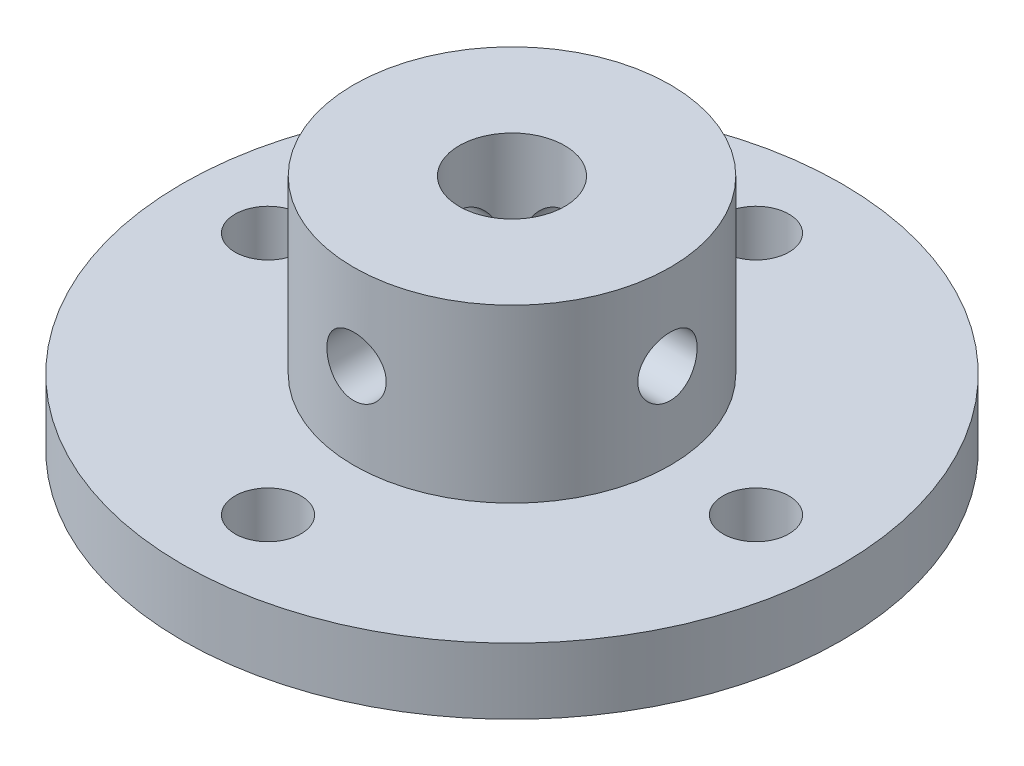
SolidWorks part; units mm, degrees
ref_plane "前视基准面" through (0, 0, 0) normal (0, 0, 1) x (1, 0, 0)
ref_plane "上视基准面" through (0, 0, 0) normal (0, 1, 0) x (1, 0, 0)
ref_plane "右视基准面" through (0, 0, 0) normal (1, 0, 0) x (0, 0, -1)
other "Configuration Table"
sketch "草图1" plane through (0, 0, 0) normal (0, 1, 0) x (1, 0, 0)
  circle A0 centre (0, 0) radius 25
  dimension "D1" = 50
extrude "凸台-拉伸1" add sketch "草图1" along normal blind 5
sketch "草图2" plane through (0, 5, 0) normal (0, 1, 0) x (1, 0, 0)
  circle A0 centre (0, 0) radius 12
  dimension "D1" = 24
extrude "凸台-拉伸2" add sketch "草图2" along normal blind 13
sketch "草图3" plane through (0, 18, 0) normal (0, 1, 0) x (1, 0, 0)
  circle A0 centre (0, 0) radius 4
  dimension "D1" = 8
extrude "切除-拉伸1" cut sketch "草图3" against normal through all
sketch "草图4" plane through (0, 5, 0) normal (0, 1, 0) x (1, 0, 0)
  circle A0 centre (0, 0) radius 18.5
  circle A1 centre (0, 18.5) radius 2.5
  circle A2 centre (18.5, 0) radius 2.5
  circle A3 centre (0, -18.5) radius 2.5
  circle A4 centre (-18.5, 0) radius 2.5
  dimension "D1" = 37
  dimension "D2" = 5
  dimension "D3" = 5
  dimension "D4" = 5
  dimension "D5" = 5
extrude "切除-拉伸2" cut sketch "草图4" against normal through all contours A0 A1 | A0 A1 | A0 A2 | A0 A2 | A0 A3 | A0 A3 | A0 A4 | A0 A4
sketch "草图5" plane through (0, 0, 0) normal (1, 0, 0) x (0, 0, -1)
  line L0 (0, 9.9) -> (0, -9.9) construction
  line L1 (12, 18) -> (-12, 18) construction
  circle A0 centre (0, 11.5) radius 2.25
  dimension "D1" = 4.5
  dimension "D2" = 6.5
extrude "切除-拉伸3" cut sketch "草图5" against normal through all and the other way through all
sketch "草图6" plane through (0, 0, 0) normal (0, 0, 1) x (1, 0, 0)
  line L0 (0, -9.9) -> (0, 9.9) construction
  line L1 (4, 18) -> (-4, 18) construction
  circle A0 centre (0, 11.5) radius 2.25
  dimension "D1" = 4.5
  dimension "D2" = 6.5
extrude "切除-拉伸4" cut sketch "草图6" against normal through all and the other way through all
